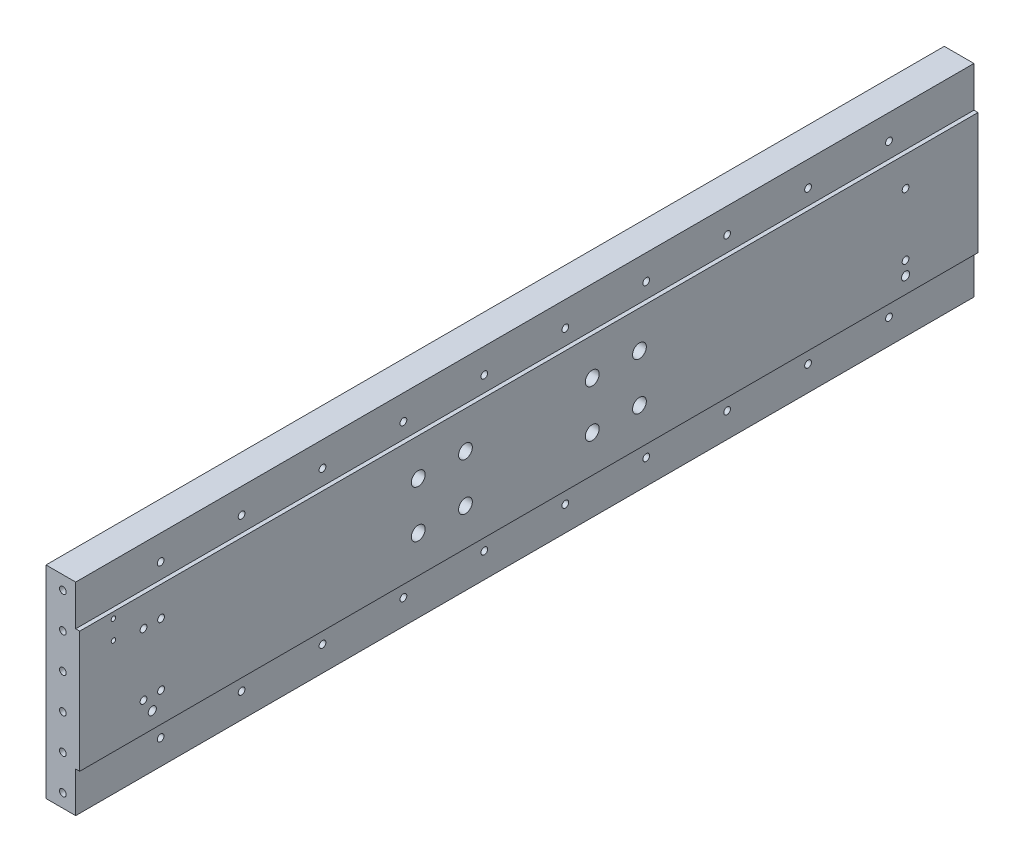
SolidWorks part; units mm, degrees
ref_plane "Ebene vorne" through (0, 0, 0) normal (0, 0, 1) x (1, 0, 0)
ref_plane "Ebene oben" through (0, 0, 0) normal (0, 1, 0) x (1, 0, 0)
ref_plane "Ebene rechts" through (0, 0, 0) normal (1, 0, 0) x (0, 0, -1)
sketch "Skizze1" plane through (0, 0, 0) normal (0, 0, 1) x (1, 0, 0)
  line L1 (0, 0) -> (25, 0)
  line L2 (0, 0) -> (0, 250)
  line L3 (0, 250) -> (25, 250)
  line L4 (25, 0) -> (25, 250)
  dimension "D1" = 25
  dimension "D2" = 250
extrude "Aufsatz-Linear austragen1" add sketch "Skizze1" along normal blind 700
sketch "Skizze2" plane through (0, 0, 700) normal (0, 0, 1) x (1, 0, 0)
  line L0 (25, 0) -> (25, 250) construction
  line L1 (22, 215) -> (44.199, 215)
  line L2 (22, 215) -> (22, 275.8875)
  line L3 (22, 275.8875) -> (44.199, 275.8875)
  line L4 (44.199, 215) -> (44.199, 275.8875)
  line L5 (22, 30) -> (41.8808, 30)
  line L6 (22, 30) -> (22, -29.6654)
  line L7 (22, -29.6654) -> (41.8808, -29.6654)
  line L8 (41.8808, 30) -> (41.8808, -29.6654)
  line L9 (25, 250) -> (0, 250) construction
  line L10 (0, 0) -> (25, 0) construction
  dimension "D1" = 3
  dimension "D2" = 3
  dimension "D3" = 35
  dimension "D4" = 30
extrude "Schnitt-Linear austragen1" cut sketch "Skizze2" against normal blind 700
sketch "Skizze3" plane through (0, 0, 700) normal (0, 0, 1) x (1, 0, 0)
  line L0 (0, 0) -> (22, 0) construction
  line L1 (0, 250) -> (93.1572, 250)
  line L2 (0, 250) -> (0, 150)
  line L3 (0, 150) -> (93.1572, 150)
  line L4 (93.1572, 250) -> (93.1572, 150)
  dimension "D1" = 150
extrude "Schnitt-Linear austragen2" cut sketch "Skizze3" against normal blind 700
sketch "Skizze4" plane through (0, 0, 700) normal (0, 0, 1) x (1, 0, 0)
  line L0 (0, 150) -> (25, 150) construction
  line L1 (22, 150) -> (25, 150)
  line L2 (22, 150) -> (22, 120)
  line L3 (22, 120) -> (25, 120)
  line L4 (25, 150) -> (25, 120)
  line L5 (25, 30) -> (25, 150) construction
  dimension "D1" = 30
  dimension "D2" = 3
extrude "Schnitt-Linear austragen3" cut sketch "Skizze4" against normal blind 700
sketch "Skizze5" plane through (25, 0, 0) normal (1, 0, 0) x (0, 0, -1)
  line L1 (-700, -38.3079) -> (-620, -38.3079)
  line L2 (-700, -38.3079) -> (-700, 203.4992)
  line L3 (-700, 203.4992) -> (-620, 203.4992)
  line L4 (-620, -38.3079) -> (-620, 203.4992)
  dimension "D1" = 80
extrude "Schnitt-Linear austragen4" cut sketch "Skizze5" against normal blind 30
sketch "Skizze6" plane through (0, 0, 620) normal (0, 0, 1) x (1, 0, 0)
  line L16 (25, 30) -> (25, 120)
  line L17 (25, 120) -> (22, 120)
  line L18 (22, 120) -> (22, 150)
  line L19 (22, 150) -> (0, 150)
  line L20 (0, 150) -> (0, 0)
  line L21 (0, 0) -> (22, 0)
  line L22 (22, 0) -> (22, 30)
  line L23 (22, 30) -> (25, 30)
  line L24 (25, 30) -> (25, 120)
  line L25 (25, 120) -> (22, 120)
  line L26 (22, 120) -> (22, 150)
  line L27 (22, 150) -> (0, 150)
  line L28 (0, 150) -> (0, 0)
  line L29 (0, 0) -> (22, 0)
  line L30 (22, 0) -> (22, 30)
  line L31 (22, 30) -> (25, 30)
  dimension "D1" = 0
extrude "Aufsatz-Linear austragen2" add sketch "Skizze6" along normal blind 80
sketch "Skizze7" plane through (25, 0, 0) normal (1, 0, 0) x (0, 0, -1)
  line L1 (0, 0) -> (-4, 0)
  line L2 (0, 0) -> (0, 191.3181)
  line L3 (0, 191.3181) -> (-4, 191.3181)
  line L4 (-4, 0) -> (-4, 191.3181)
  dimension "D1" = 4
extrude "Schnitt-Linear austragen5" cut sketch "Skizze7" against normal blind 100
sketch "Skizze8" plane through (25, 0, 0) normal (1, 0, 0) x (0, 0, -1)
  line L1 (-4, 0) -> (-34, 0)
  line L2 (-4, 0) -> (-4, 183.2174)
  line L3 (-4, 183.2174) -> (-34, 183.2174)
  line L4 (-34, 0) -> (-34, 183.2174)
  dimension "D1" = 30
extrude "Schnitt-Linear austragen6" cut sketch "Skizze8" against normal blind 100
sketch "Skizze9" plane through (22, 0, 0) normal (1, 0, 0) x (0, 0, -1)
  line L0 (-34, 120) -> (-700, 120) construction
  line L1 (-667, 120) -> (-67, 120)
  line L2 (-667, 120) -> (-667, 131.5)
  line L3 (-667, 131.5) -> (-67, 131.5)
  line L4 (-67, 120) -> (-67, 131.5)
  line L5 (-34, 30) -> (-700, 30) construction
  line L6 (-667, 30) -> (-67, 30)
  line L7 (-667, 30) -> (-667, 18.5)
  line L8 (-667, 18.5) -> (-67, 18.5)
  line L9 (-67, 30) -> (-67, 18.5)
  line L10 (-700, 120) -> (-700, 150) construction
  line L11 (-700, 0) -> (-700, 30) construction
  line L12 (-34, 120) -> (-34, 150) construction
  line L13 (-34, 0) -> (-34, 30) construction
  line L14 (-337, 131.5) -> (-337, 18.5)
  line L15 (-637, 131.5) -> (-577, 131.5)
  line L16 (-637, 131.5) -> (-637, 18.5)
  line L17 (-637, 18.5) -> (-577, 18.5)
  line L18 (-577, 131.5) -> (-577, 18.5)
  line L19 (-517, 131.5) -> (-457, 131.5)
  line L20 (-517, 131.5) -> (-517, 18.5)
  line L21 (-517, 18.5) -> (-457, 18.5)
  line L22 (-457, 131.5) -> (-457, 18.5)
  line L23 (-397, 131.5) -> (-217, 131.5)
  line L24 (-397, 131.5) -> (-397, 18.5)
  line L25 (-397, 18.5) -> (-217, 18.5)
  line L26 (-217, 131.5) -> (-217, 18.5)
  line L27 (-157, 131.5) -> (-97, 131.5)
  line L28 (-157, 131.5) -> (-157, 18.5)
  line L29 (-157, 18.5) -> (-97, 18.5)
  line L30 (-97, 131.5) -> (-97, 18.5)
  line L31 (-277, 131.5) -> (-277, 18.5)
  dimension "D1" = 11.5
  dimension "D2" = 11.5
  dimension "D3" = 33
  dimension "D4" = 33
  dimension "D5" = 33
  dimension "D6" = 33
  dimension "D7" = 30
  dimension "D8" = 30
  dimension "D9" = 60
  dimension "D10" = 60
  dimension "D11" = 60
  dimension "D12" = 60
  dimension "D13" = 60
  dimension "D14" = 60
  dimension "D15" = 60
  dimension "D16" = 60
hole_wizard "M6 Gewindebohrung1" positions "Skizze11" profile "Skizze10" tap size "M6" standard "ISO"
sketch "Skizze11" plane through (22, 0, 0) normal (1, 0, 0) x (0, 0, -1)
  point P0 (-637, 131.5)
  point P4 (-577, 131.5)
  point P8 (-517, 131.5)
  point P12 (-457, 131.5)
  point P16 (-397, 131.5)
  point P20 (-337, 131.5)
  point P24 (-277, 131.5)
  point P28 (-217, 131.5)
  point P32 (-157, 131.5)
  point P36 (-97, 131.5)
  point P40 (-637, 18.5)
  point P44 (-577, 18.5)
  point P48 (-517, 18.5)
  point P52 (-457, 18.5)
  point P56 (-397, 18.5)
  point P60 (-337, 18.5)
  point P64 (-277, 18.5)
  point P68 (-217, 18.5)
  point P72 (-157, 18.5)
  point P76 (-97, 18.5)
sketch "Skizze10" plane through (22, 131.5, 637) normal (0, 1, 0) x (0, 0, -1)
  line L0 (0, 0) -> (0, 20.5022)
  line L1 (0, 20.5022) -> (2.5, 19)
  line L2 (2.5, 19) -> (2.5, 0)
  line L5 (2.5, 0) -> (0, 0)
  line L10 (0, 20.5022) -> (-2.5, 19) construction
  line L11 (0, -6.35) -> (0, 107.95) construction
  dimension "Bohrerdurchmesser" = 5
  dimension "Bohrungstiefe" = 19
  dimension "Spitzenwinkel" = 118
sketch "Skizze12" plane through (25, 0, 0) normal (1, 0, 0) x (0, 0, -1)
  line L0 (-639.7, 98) -> (-639.7, 52)
  line L1 (-652.7, 98) -> (-87.7, 98)
  line L2 (-652.7, 98) -> (-652.7, 52)
  line L3 (-652.7, 52) -> (-87.7, 52)
  line L4 (-87.7, 98) -> (-87.7, 52)
  line L5 (-700, 30) -> (-700, 120) construction
  line L6 (-34, 0) -> (-700, 0) construction
  dimension "D1" = 47.3
  dimension "D2" = 13
  dimension "D3" = 612.3
  dimension "D4" = 46
  dimension "D5" = 52
hole_wizard "M6 Gewindebohrung2" positions "Skizze14" profile "Skizze13" tap size "M6" standard "ISO"
sketch "Skizze14" plane through (25, 0, 0) normal (1, 0, 0) x (0, 0, -1)
  point P0 (-652.7, 98)
  point P4 (-639.7, 98)
  point P8 (-652.7, 52)
  point P12 (-639.7, 52)
  point P16 (-87.7, 98)
  point P20 (-87.7, 52)
sketch "Skizze13" plane through (25, 98, 652.7) normal (0, 1, 0) x (0, 0, -1)
  line L0 (0, 0) -> (0, 21.5022)
  line L1 (0, 21.5022) -> (2.5, 20)
  line L2 (2.5, 20) -> (2.5, 0)
  line L5 (2.5, 0) -> (0, 0)
  line L10 (0, 21.5022) -> (-2.5, 20) construction
  line L11 (0, -6.35) -> (0, 107.95) construction
  dimension "Bohrerdurchmesser" = 5
  dimension "Bohrungstiefe" = 20
  dimension "Spitzenwinkel" = 118
sketch "Skizze15" plane through (25, 0, 0) normal (1, 0, 0) x (0, 0, -1)
  line L1 (-652.7, 98) -> (-87.7, 98)
  line L2 (-652.7, 98) -> (-652.7, 52)
  line L3 (-652.7, 52) -> (-87.7, 52)
  line L4 (-87.7, 98) -> (-87.7, 52)
  line L5 (-646.2, 52) -> (-87.7, 52)
  line L6 (-646.2, 52) -> (-646.2, 42)
  line L7 (-646.2, 42) -> (-87.7, 42)
  line L8 (-87.7, 52) -> (-87.7, 42)
  circle A0 centre (-646.2, 42) radius 3
  circle A1 centre (-87.7, 42) radius 3
  dimension "D3" = 6
  dimension "D4" = 6
  dimension "D1" = 6.5
  dimension "D2" = 10
extrude "Schnitt-Linear austragen7" cut sketch "Skizze15" against normal blind 15 contours A0 | A1
sketch "Skizze16" plane through (0, 0, 34) normal (0, 0, -1) x (-1, 0, 0)
  line L0 (-12.5, 150) -> (-12.5, 0)
  line L1 (-22, 150) -> (0, 150) construction
  line L2 (0, 0) -> (-22, 0) construction
  line L3 (0, 150) -> (0, 0) construction
  line L4 (-12.5, 140) -> (0, 140)
  line L5 (-12.5, 140) -> (-12.5, 114)
  line L6 (-12.5, 114) -> (0, 114)
  line L7 (0, 140) -> (0, 114)
  line L8 (-12.5, 88) -> (0, 88)
  line L9 (-12.5, 88) -> (-12.5, 62)
  line L10 (-12.5, 62) -> (0, 62)
  line L11 (0, 88) -> (0, 62)
  line L13 (-12.5, 36) -> (0, 36)
  line L14 (-12.5, 36) -> (-12.5, 10)
  line L15 (-12.5, 10) -> (0, 10)
  line L16 (0, 36) -> (0, 10)
  dimension "D1" = 10
  dimension "D2" = 10
  dimension "D3" = 26
  dimension "D4" = 26
  dimension "D5" = 26
  dimension "D6" = 26
  dimension "D7" = 12.5
sketch "Skizze20" plane through (0, 0, 700) normal (0, 0, 1) x (1, 0, 0)
  line L0 (12.5, 150) -> (12.5, 0)
  line L1 (22, 150) -> (0, 150) construction
  line L2 (0, 0) -> (22, 0) construction
  line L3 (0, 150) -> (0, 0) construction
  line L4 (0, 140) -> (12.5, 140)
  line L5 (0, 140) -> (0, 114)
  line L6 (0, 114) -> (12.5, 114)
  line L7 (12.5, 140) -> (12.5, 114)
  line L9 (0, 88) -> (12.5, 88)
  line L10 (0, 88) -> (0, 62)
  line L11 (0, 62) -> (12.5, 62)
  line L12 (12.5, 88) -> (12.5, 62)
  line L13 (0, 36) -> (12.5, 36)
  line L14 (0, 36) -> (0, 10)
  line L15 (0, 10) -> (12.5, 10)
  line L16 (12.5, 36) -> (12.5, 10)
  dimension "D1" = 12.5
  dimension "D2" = 10
  dimension "D3" = 10
  dimension "D4" = 26
  dimension "D5" = 26
  dimension "D6" = 26
  dimension "D7" = 26
sketch "Skizze23" plane through (0, 0, 700) normal (0, 0, 1) x (1, 0, 0)
  line L0 (12.5, 150) -> (12.5, 0)
  line L1 (22, 150) -> (0, 150) construction
  line L2 (0, 0) -> (22, 0) construction
  line L3 (0, 150) -> (0, 0) construction
  line L4 (12.5, 140) -> (0, 140)
  line L5 (12.5, 140) -> (12.5, 114)
  line L6 (12.5, 114) -> (0, 114)
  line L7 (0, 140) -> (0, 114)
  line L9 (12.5, 88) -> (0, 88)
  line L10 (12.5, 88) -> (12.5, 62)
  line L11 (12.5, 62) -> (0, 62)
  line L12 (0, 88) -> (0, 62)
  line L13 (12.5, 36) -> (0, 36)
  line L14 (12.5, 36) -> (12.5, 10)
  line L15 (12.5, 10) -> (0, 10)
  line L16 (0, 36) -> (0, 10)
  dimension "D1" = 10
  dimension "D2" = 10
  dimension "D3" = 26
  dimension "D4" = 26
  dimension "D5" = 26
  dimension "D6" = 26
  dimension "D7" = 12.5
hole_wizard "M6 Gewindebohrung3" positions "Skizze25" profile "Skizze24" tap size "M6" standard "ISO"
sketch "Skizze25" plane through (0, 0, 700) normal (0, 0, 1) x (1, 0, 0)
  point P0 (12.5, 140)
  point P4 (12.5, 114)
  point P8 (12.5, 88)
  point P12 (12.5, 62)
  point P16 (12.5, 36)
  point P20 (12.5, 10)
sketch "Skizze24" plane through (12.5, 140, 700) normal (1, 0, 0) x (0, -1, 0)
  line L0 (0, 0) -> (0, 26.5022)
  line L1 (0, 26.5022) -> (2.5, 25)
  line L2 (2.5, 25) -> (2.5, 0)
  line L5 (2.5, 0) -> (0, 0)
  line L10 (0, 26.5022) -> (-2.5, 25) construction
  line L11 (0, -6.35) -> (0, 107.95) construction
  dimension "Bohrerdurchmesser" = 5
  dimension "Bohrungstiefe" = 25
  dimension "Spitzenwinkel" = 118
sketch "Skizze26" plane through (0, 0, 34) normal (0, 0, -1) x (-1, 0, 0)
  line L0 (-12.5, 150) -> (-12.5, 0)
  line L1 (-22, 150) -> (0, 150) construction
  line L2 (0, 0) -> (-22, 0) construction
  line L3 (0, 150) -> (0, 0) construction
  line L4 (-12.5, 140) -> (0, 140)
  line L5 (-12.5, 140) -> (-12.5, 114)
  line L6 (-12.5, 114) -> (0, 114)
  line L7 (0, 140) -> (0, 114)
  line L9 (-12.5, 88) -> (0, 88)
  line L10 (-12.5, 88) -> (-12.5, 62)
  line L11 (-12.5, 62) -> (0, 62)
  line L12 (0, 88) -> (0, 62)
  line L13 (-12.5, 36) -> (0, 36)
  line L14 (-12.5, 36) -> (-12.5, 10)
  line L15 (-12.5, 10) -> (0, 10)
  line L16 (0, 36) -> (0, 10)
  dimension "D1" = 10
  dimension "D2" = 10
  dimension "D3" = 26
  dimension "D4" = 26
  dimension "D5" = 26
  dimension "D6" = 26
  dimension "D7" = 12.5
hole_wizard "M6 Gewindebohrung4" positions "Skizze28" profile "Skizze27" tap size "M6" standard "ISO"
sketch "Skizze28" plane through (0, 0, 34) normal (0, 0, -1) x (-1, 0, 0)
  point P0 (-12.5, 140)
  point P4 (-12.5, 114)
  point P8 (-12.5, 88)
  point P12 (-12.5, 62)
  point P16 (-12.5, 36)
  point P20 (-12.5, 10)
sketch "Skizze27" plane through (12.5, 140, 34) normal (1, 0, 0) x (0, 1, 0)
  line L0 (0, 0) -> (0, 26.5022)
  line L1 (0, 26.5022) -> (2.5, 25)
  line L2 (2.5, 25) -> (2.5, 0)
  line L5 (2.5, 0) -> (0, 0)
  line L10 (0, 26.5022) -> (-2.5, 25) construction
  line L11 (0, -6.35) -> (0, 107.95) construction
  dimension "Bohrerdurchmesser" = 5
  dimension "Bohrungstiefe" = 25
  dimension "Spitzenwinkel" = 118
sketch "Skizze29" plane through (25, 0, 0) normal (1, 0, 0) x (0, 0, -1)
  line L1 (-449, 57.5) -> (-414, 57.5)
  line L2 (-449, 57.5) -> (-449, 92.5)
  line L3 (-449, 92.5) -> (-414, 92.5)
  line L4 (-414, 57.5) -> (-414, 92.5)
  line L5 (-449, 57.5) -> (-414, 92.5) construction
  line L6 (-449, 92.5) -> (-414, 57.5) construction
  line L7 (-320, 57.5) -> (-285, 57.5)
  line L8 (-320, 57.5) -> (-320, 92.5)
  line L9 (-320, 92.5) -> (-285, 92.5)
  line L10 (-285, 57.5) -> (-285, 92.5)
  line L11 (-320, 57.5) -> (-285, 92.5) construction
  line L12 (-320, 92.5) -> (-285, 57.5) construction
  line L13 (-700, 30) -> (-700, 120) construction
  line L15 (-34, 150) -> (-700, 150) construction
  point P0 (-431.5, 75)
  point P5 (-302.5, 75)
  dimension "D1" = 35
  dimension "D2" = 35
  dimension "D3" = 35
  dimension "D4" = 35
  dimension "D5" = 94
  dimension "D6" = 251
  dimension "D7" = 57.5
  dimension "D8" = 57.5
hole_wizard "M12 Gewindebohrung1" positions "Skizze31" profile "Skizze30" tap size "M12" standard "ISO"
sketch "Skizze31" plane through (25, 0, 0) normal (1, 0, 0) x (0, 0, -1)
  point P0 (-449, 92.5)
  point P4 (-449, 57.5)
  point P8 (-414, 92.5)
  point P12 (-414, 57.5)
  point P16 (-320, 92.5)
  point P20 (-320, 57.5)
  point P24 (-285, 57.5)
  point P28 (-285, 92.5)
sketch "Skizze30" plane through (25, 92.5, 449) normal (0, 1, 0) x (0, 0, -1)
  line L0 (0, 0) -> (0, 25)
  line L1 (0, 25) -> (5.1, 25)
  line L2 (5.1, 25) -> (5.1, 0)
  line L5 (5.1, 0) -> (0, 0)
  line L11 (0, -6.35) -> (0, 107.95) construction
  dimension "Bohrerdurchmesser" = 10.2
  dimension "Bohrungstiefe" = 25
sketch "Skizze32" plane through (0, 0, 0) normal (-1, 0, 0) x (0, 0, 1)
  circle A0 centre (285, 92.5) radius 12
  circle A1 centre (320, 92.5) radius 12
  circle A2 centre (320, 57.5) radius 12
  circle A3 centre (285, 57.5) radius 12
  circle A4 centre (414, 57.5) radius 12
  circle A5 centre (449, 57.5) radius 12
  circle A6 centre (449, 92.5) radius 12
  circle A7 centre (414, 92.5) radius 12
  dimension "D1" = 24
  dimension "D2" = 24
  dimension "D3" = 24
  dimension "D4" = 24
  dimension "D5" = 24
  dimension "D6" = 24
  dimension "D7" = 24
  dimension "D8" = 24
extrude "Schnitt-Linear austragen8" cut sketch "Skizze32" against normal blind 1
chamfer "Fase2" distance 6.5 angle 45 1 edges at (1, 92.5, 290.1)
chamfer "Fase3" distance 6.5 angle 45 1 edges at (1, 92.5, 325.1)
chamfer "Fase4" distance 6.5 angle 45 1 edges at (1, 57.5, 325.1)
chamfer "Fase5" distance 6.5 angle 45 1 edges at (1, 57.5, 290.1)
chamfer "Fase6" distance 6.5 angle 45 4 edges at (1, 57.5, 454.1) (1, 57.5, 419.1) (1, 92.5, 454.1) (1, 92.5, 419.1)
sketch "Skizze33" plane through (25, 0, 0) normal (1, 0, 0) x (0, 0, -1)
  line L0 (-675, 115.5) -> (-675, 101.5) construction
  line L1 (-34, 120) -> (-700, 120) construction
  line L2 (-700, 30) -> (-700, 120) construction
  dimension "D1" = 4.5
  dimension "D2" = 14
  dimension "D3" = 25
hole_wizard "M4 Gewindebohrung1" positions "Skizze35" profile "Skizze34" tap size "M4" standard "ISO"
sketch "Skizze35" plane through (25, 0, 0) normal (1, 0, 0) x (0, 0, -1)
  point P0 (-675, 115.5)
  point P4 (-675, 101.5)
sketch "Skizze34" plane through (25, 115.5, 675) normal (0, 1, 0) x (0, 0, -1)
  line L0 (0, 0) -> (0, 8.9914)
  line L1 (0, 8.9914) -> (1.65, 8)
  line L2 (1.65, 8) -> (1.65, 0)
  line L5 (1.65, 0) -> (0, 0)
  line L10 (0, 8.9914) -> (-1.65, 8) construction
  line L11 (0, -6.35) -> (0, 107.95) construction
  dimension "Bohrerdurchmesser" = 3.3
  dimension "Bohrungstiefe" = 8
  dimension "Spitzenwinkel" = 118
